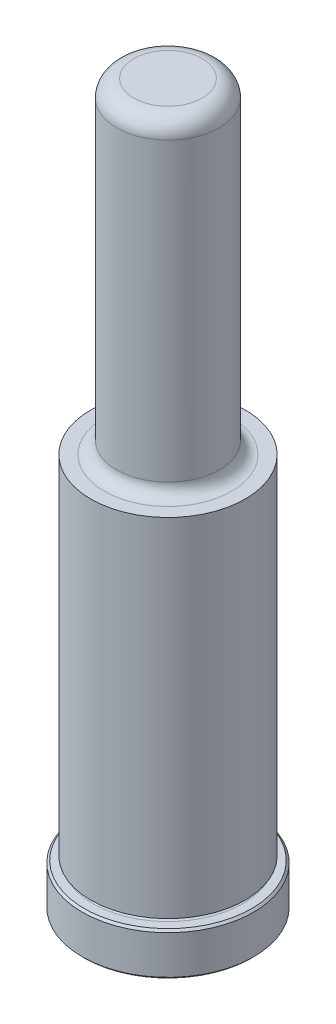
SolidWorks part; units mm, degrees
ref_plane "Front Plane" through (0, 0, 0) normal (0, 0, 1) x (1, 0, 0)
ref_plane "Top Plane" through (0, 0, 0) normal (0, 1, 0) x (1, 0, 0)
ref_plane "Right Plane" through (0, 0, 0) normal (1, 0, 0) x (0, 0, -1)
sketch "Sketch1" plane through (0, 0, 0) normal (1, 0, 0) x (0, 0, -1)
  line L0 (0, 0) -> (15.875, 0)
  line L1 (15.875, 0) -> (15.875, 7.9248)
  line L2 (15.875, 7.9248) -> (13.8938, 7.9248)
  line L3 (13.5128, 2.6782) -> (13.5128, 5.9795) construction
  line L4 (13.8938, 8.6868) -> (14.3002, 8.6868)
  line L5 (14.3002, 8.6868) -> (14.3002, 73.025)
  line L6 (14.3002, 73.025) -> (11.7983, 73.025)
  line L7 (9.5123, 75.311) -> (9.5123, 133.35)
  line L9 (9.5123, 133.35) -> (0, 133.35)
  line L10 (0, 133.35) -> (0, 0)
  line L11 (0, 0) -> (0, -7.2694) construction
  arc A0 (13.8938, 8.6868) -> (13.8938, 7.9248) centre (13.8938, 8.3058) ccw
  arc A1 (11.7983, 73.025) -> (9.5123, 75.311) centre (11.7983, 75.311) cw
  point P2 (9.5123, 133.35)
  point P14 (9.5123, 133.1327)
  point P19 (9.5123, 73.025)
  dimension "D14" = 0.762
  dimension "D8" = 2.286
  dimension "T" = 7.9248
  dimension "D2" = 0.762
  dimension "M" = 31.75
  dimension "B" = 28.6004
  dimension "L" = 133.35
  dimension "D7" = 0.7874
  dimension "A" = 73.025
  dimension "D" = 19.0246
  dimension "D15" = 60.325
revolve "Revolve1" add sketch "Sketch1" angle 360 about L11
chamfer "Chamfer1" distance 0.381 angle 45 2 edges at (0, 0, 15.875) (0, 7.9248, 15.875)
fillet "Fillet7" radius 3.175 1 edges at (0, 133.35, 9.5123)
